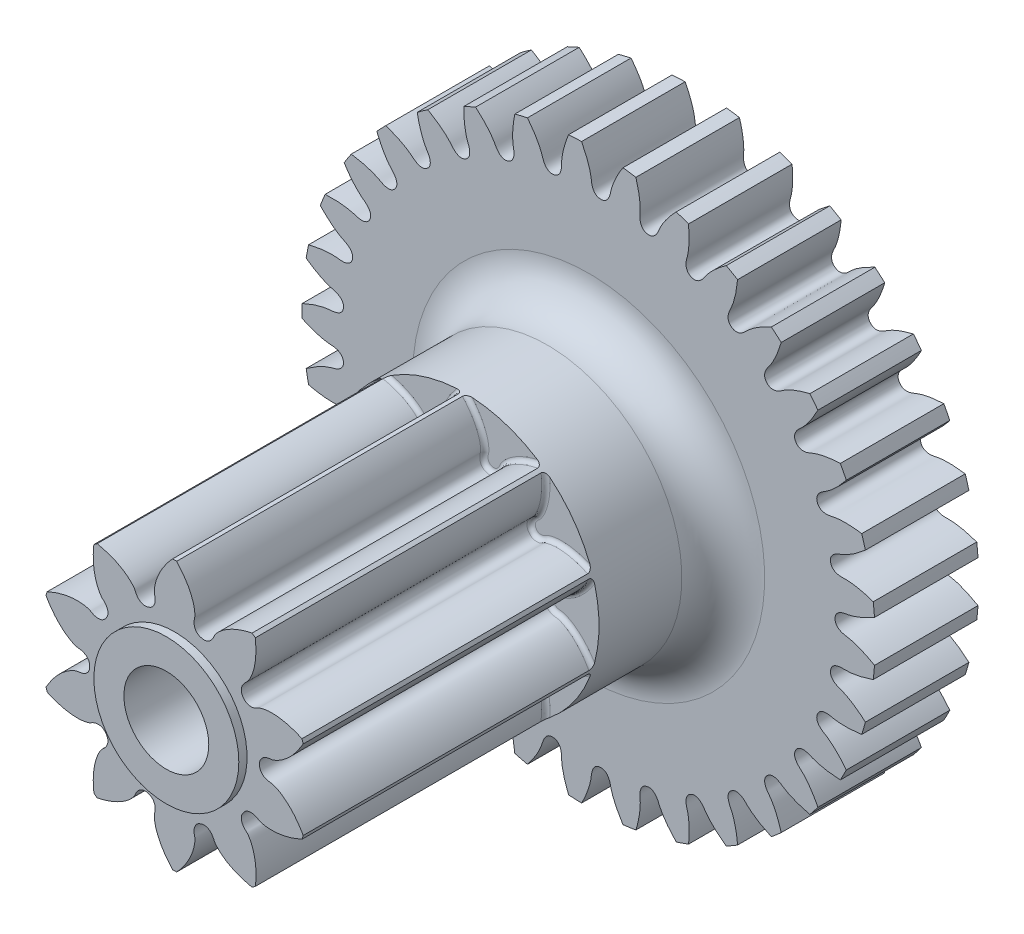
SolidWorks part; units mm, degrees
ref_plane "Front Plane" through (0, 0, 0) normal (0, 0, 1) x (1, 0, 0)
ref_plane "Top Plane" through (0, 0, 0) normal (0, 1, 0) x (1, 0, 0)
ref_plane "Right Plane" through (0, 0, 0) normal (1, 0, 0) x (0, 0, -1)
imported_body "Imported3"
sketch "Sketch1" plane through (0, 0, 11.25) normal (0, 0, 1) x (1, 0, 0)
  circle A0 centre (0, 0) radius 1.75
extrude "Boss-Extrude1" add sketch "Sketch1" along normal blind 0.2
sketch "Sketch2" plane through (0, 0, 0) normal (0, 1, 0) x (1, 0, 0)
  line L0 (2, 1.55) -> (0, 1.55)
  line L1 (0, 1.55) -> (0, 1.25)
  line L2 (0, 1.25) -> (2, 1.25)
  line L3 (2, 1.25) -> (2, 1.55)
  line L4 (0, 1.55) -> (0, 1.25) construction
revolve "Revolve1" add sketch "Sketch2" angle 360 about L4
hole_wizard "#1 Clearance Hole1" positions "Sketch4" profile "Sketch3" hole size "#1" standard "ANSI Inch"
sketch "Sketch4" plane through (0, 0, 11.45) normal (0, 0, 1) x (1, 0, 0)
  point P0 (0, 0)
sketch "Sketch3" plane through (0, 0, 11.45) normal (1, 0, 0) x (0, -1, 0)
  line L0 (0, 0) -> (0, 13)
  line L1 (0, 13) -> (1.025, 13)
  line L2 (1.025, 13) -> (1.025, 0)
  line L5 (1.025, 0) -> (0, 0)
  line L11 (0, -6.35) -> (0, 107.95) construction
  dimension "Thru Hole Dia." = 2.05
  dimension "Thru Hole Depth" = 13
fillet "Fillet1" radius 1 1 edges at (-3.25, 0, 1.25)
